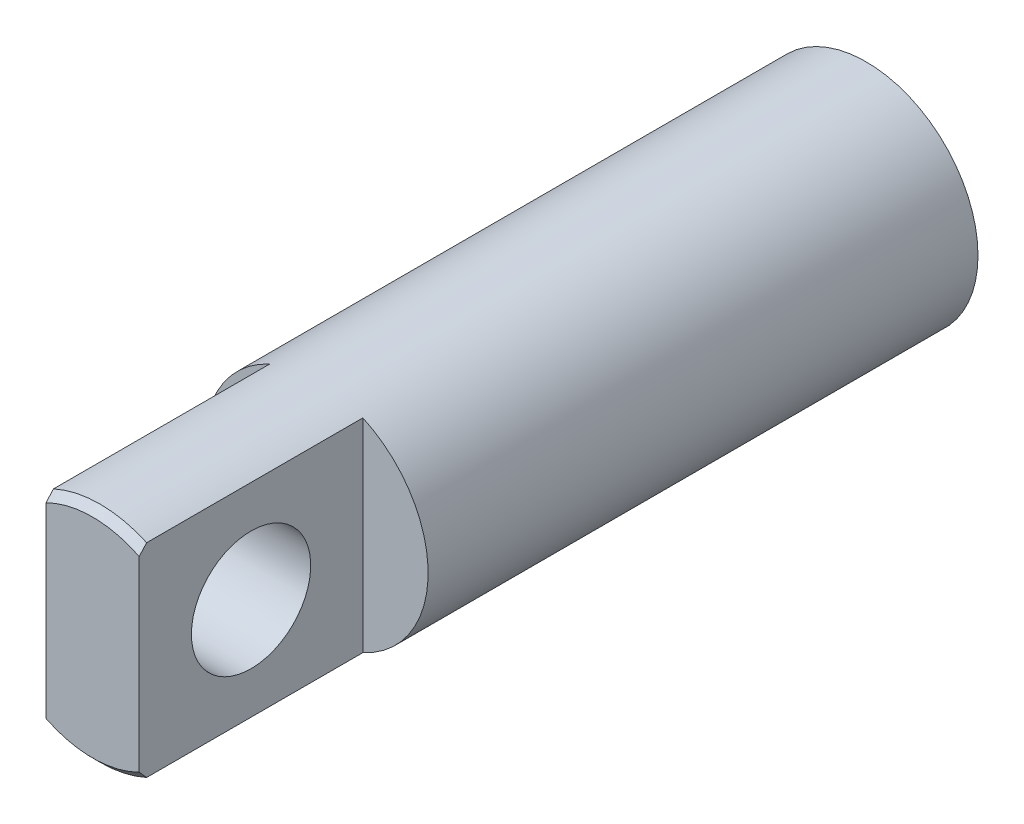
SolidWorks part; units mm, degrees
ref_plane "Front Plane" through (0, 0, 0) normal (0, 0, 1) x (1, 0, 0)
ref_plane "Top Plane" through (0, 0, 0) normal (0, 1, 0) x (1, 0, 0)
ref_plane "Right Plane" through (0, 0, 0) normal (1, 0, 0) x (0, 0, -1)
sketch "Sketch1" plane through (0, 0, 0) normal (0, 0, 1) x (1, 0, 0)
  circle A0 centre (0, 0) radius 3
  dimension "D1" = 6
extrude "Boss-Extrude1" add sketch "Sketch1" along normal blind 14.75
sketch "Sketch2" plane through (0, 0, 14.75) normal (0, 0, 1) x (1, 0, 0)
  line L0 (0, 0) -> (0, 3.1265) construction
  line L1 (1.25, -2.7272) -> (1.25, 2.7272)
  line L2 (-1.25, -2.7272) -> (-1.25, 2.7272)
  line L3 (-1.25, 0) -> (-1.25, 3.1265) construction
  line L4 (1.25, 0) -> (1.25, 3.1265) construction
  arc A0 (-1.25, -2.7272) -> (1.25, -2.7272) centre (0, 0) ccw
  arc A1 (1.25, 2.7272) -> (-1.25, 2.7272) centre (0, 0) ccw
  dimension "D1" = 6
  dimension "D2" = 1.25
  dimension "D3" = 1.25
extrude "Boss-Extrude2" add sketch "Sketch2" along normal blind 6
sketch "Sketch3" plane through (-1.25, 0, 0) normal (-1, 0, 0) x (0, 0, 1)
  line L0 (20.75, 2.7272) -> (20.75, -2.7272) construction
  circle A0 centre (17.75, 0) radius 1.6
  dimension "D3" = 3.2
  dimension "D1" = 3
extrude "Cut-Extrude1" cut sketch "Sketch3" against normal up to surface (2.5 mm away)
chamfer "Chamfer1" distance 0.2 angle 45 2 edges at (0, -3, 20.75) (0, 3, 20.75)
